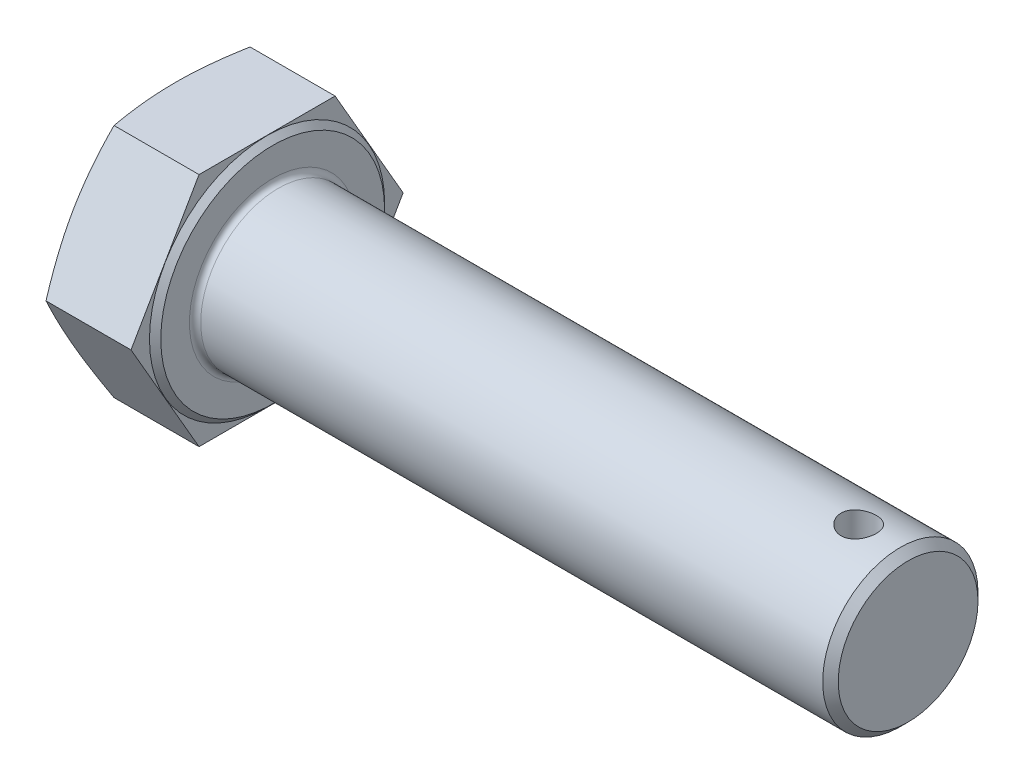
SolidWorks part; units mm, degrees
ref_plane "Front" through (0, 0, 0) normal (0, 0, 1) x (1, 0, 0)
ref_plane "Top" through (0, 0, 0) normal (0, 1, 0) x (1, 0, 0)
ref_plane "Right" through (0, 0, 0) normal (1, 0, 0) x (0, 0, -1)
sketch "Sketch2" plane through (0, 0, 0) normal (1, 0, 0) x (0, 0, -1)
  line L1 (19.272, 0) -> (9.636, 16.69)
  line L2 (9.636, 16.69) -> (-9.636, 16.69)
  line L3 (-9.636, 16.69) -> (-19.272, 0)
  line L4 (-19.272, 0) -> (-9.636, -16.69)
  line L5 (-9.636, -16.69) -> (9.636, -16.69)
  line L6 (9.636, -16.69) -> (19.272, 0)
  circle A0 centre (0, 0) radius 16.69 construction
  dimension "s" = 33.38
extrude "BaseHead" add sketch "Sketch2" along normal blind 13.78
sketch "Sketch3" plane through (0, 0, 0) normal (0, 1, 0) x (1, 0, 0)
  line L0 (13.78, 19.272) -> (13.78, 15.855)
  line L2 (13.78, 15.855) -> (12.98, 16.655)
  line L3 (12.98, 16.655) -> (12.98, 19.272)
  line L5 (12.98, 19.272) -> (13.78, 19.272)
  line L6 (-0.9571, 0) -> (7.6478, 0) construction
  line L9 (13.78, 19.272) -> (0, 19.272) construction
  dimension "D1" = 45
  dimension "c" = 0.8
  dimension "dw" = 31.71
revolve "BearingFace" cut sketch "Sketch3" angle 360 about L6
sketch "Sketch4" plane through (0, 0, 0) normal (0, 1, 0) x (1, 0, 0)
  line L0 (-0.4935, 0) -> (3.5626, 0) construction
  line L2 (0, 19.272) -> (0.9398, 19.272)
  line L4 (0.9398, 19.272) -> (0, 16.69)
  line L6 (0, 16.69) -> (0, 19.272)
  line L7 (12.98, 19.272) -> (0, 19.272) construction
  dimension "D1" = 20
  dimension "D2" = 33.38
revolve "HeadChamfer" cut sketch "Sketch4" angle 360 about L0
sketch "Sketch5" plane through (13.78, 0, 0) normal (1, 0, 0) x (0, 0, -1)
  circle A0 centre (0, 0) radius 11
  dimension "d" = 22
extrude "BaseBody" add sketch "Sketch5" along normal blind 90
chamfer "Chamfer1" distance 1.1 angle 45 1 edges at (103.78, 0, -11)
ref_plane "Plane1" through (53.78, 0, 0) normal (1, 0, 0) x (0, 0, -1)
sketch "Sketch6" plane through (0, 0, 0) normal (0, 1, 0) x (1, 0, 0)
  line L3 (13.78, -15.855) -> (13.78, 15.855) construction
  line L4 (102.68, 0) -> (13.78, 0) construction
  circle A0 centre (96.78, 0) radius 2.5
  dimension "d1" = 5
  dimension "lh" = 83
extrude "Hole" cut sketch "Sketch6" against normal through all and the other way through all
fillet "HeadFillet" radius 0.8 1 edges at (13.78, 0, -11)
equation "\"D2@Sketch4\" = \"s@Sketch2\""
equation "\"b@ThreadCosmetic1\" = \"l@BaseBody\" - \"lg@Plane1\""
equation "\"D1@Chamfer1\" = 0.05 * \"d@Sketch5\""
